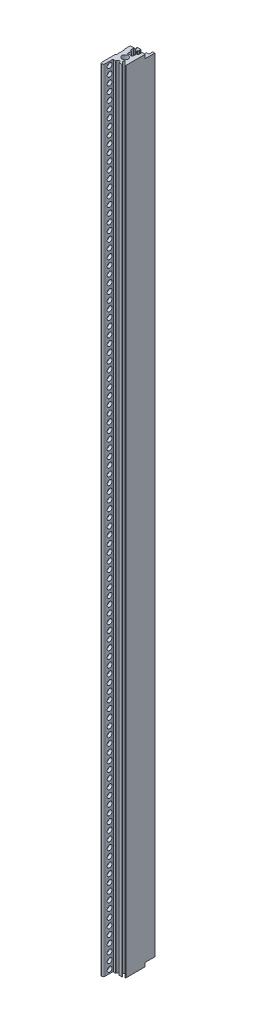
SolidWorks part; units mm, degrees
ref_plane "前视基准面" through (0, 0, 0) normal (0, 0, 1) x (1, 0, 0)
ref_plane "上视基准面" through (0, 0, 0) normal (0, 1, 0) x (1, 0, 0)
ref_plane "右视基准面" through (0, 0, 0) normal (1, 0, 0) x (0, 0, -1)
sketch "草图1" plane through (0, 0, 0) normal (0, 1, 0) x (1, 0, 0)
  line L0 (-4.2, 11.9) -> (-3.9, 11.9)
  line L1 (-4.4, 12.2) -> (-4.4, 12.1)
  line L2 (-4.0328, 12.4) -> (-4.2, 12.4)
  line L3 (-3.85, 12.5) -> (-3.8914, 12.4586)
  line L4 (-2.05, 12.5) -> (-3.85, 12.5)
  line L5 (-2.0086, 12.4586) -> (-2.05, 12.5)
  line L6 (-1.7, 12.4) -> (-1.8672, 12.4)
  line L7 (-1.5, 12.1) -> (-1.5, 12.2)
  line L8 (-1.8, 11.9) -> (-1.7, 11.9)
  line L9 (-2, 11.4828) -> (-2, 11.7)
  line L10 (-1.3586, 10.7586) -> (-1.9414, 11.3414)
  line L11 (-1.3, 10.55) -> (-1.3, 10.6172)
  line L12 (-3.7, 11.7) -> (-3.7, 9.95)
  line L13 (-5, -10.75) -> (-5, -1.6)
  line L14 (-3, -10.75) -> (-3, -5.75)
  line L15 (-2.5, -5.25) -> (-1.15, -5.25)
  line L16 (1.6887, -3.3855) -> (3.2118, -4.9086)
  line L17 (2.5373, -2.537) -> (4.6586, -4.6583)
  line L18 (5, 15) -> (5, 5.1793)
  line L19 (3.6, 15) -> (5, 15)
  line L20 (3.6, 12.5) -> (3.6, 15)
  line L21 (1.95, 12.5) -> (3.6, 12.5)
  line L22 (1.95, 10.55) -> (1.95, 12.5)
  line L23 (2.85, 10.55) -> (1.95, 10.55)
  line L24 (2.85, 9.35) -> (2.85, 10.55)
  line L25 (1.95, 9.35) -> (2.85, 9.35)
  line L26 (1.95, 8.35) -> (1.95, 9.35)
  line L27 (2.85, 8.35) -> (1.95, 8.35)
  line L28 (2.85, 6.05) -> (2.85, 8.35)
  line L29 (1.95, 6.05) -> (2.85, 6.05)
  line L30 (1.95, 3.8856) -> (1.95, 6.05)
  line L31 (-1.45, 6.05) -> (-1.45, 2.9458)
  line L32 (-2.35, 6.05) -> (-1.45, 6.05)
  line L33 (-2.35, 8.35) -> (-2.35, 6.05)
  line L34 (-1.45, 8.35) -> (-2.35, 8.35)
  line L35 (-1.45, 9.35) -> (-1.45, 8.35)
  line L36 (-2.35, 9.35) -> (-1.45, 9.35)
  line L37 (-2.35, 10.55) -> (-2.35, 9.35)
  line L38 (-1.3, 10.55) -> (-2.35, 10.55)
  line L39 (-4.45, 7.7) -> (-4.7, 7.7) construction
  line L40 (-5, 7.4) -> (-4.7, 7.7) construction
  line L41 (-5, 4.4) -> (-5, 7.4)
  line L42 (-4.5499, 3.8998) -> (-5, 4.4)
  line L43 (-4.45, 8.5) -> (-4.45, 9.55)
  line L44 (-3.9, 9.75) -> (-4.25, 9.75)
  line L45 (-4.5499, 3.8998) -> (-4.5501, -1.1002)
  line L46 (-5, -1.6) -> (-4.5501, -1.1002)
  line L47 (4.9414, -1.9395) -> (4.2929, -1.291) construction
  line L48 (5, -2.081) -> (5, -4.5169)
  line L49 (0, 0) -> (0, -5) construction
  line L50 (4, -0.5839) -> (4, 3.6823) construction
  line L51 (-1.05, -5) -> (-1.05, -5.15)
  line L52 (1.05, -5) -> (1.05, -5.15)
  line L53 (1.15, -5.25) -> (3.0703, -5.25)
  line L54 (2.5373, -2.537) -> (1.6887, -3.3855) construction
  line L55 (5, 5.1793) -> (5, -2.081)
  line L56 (-4.45, 8.5) -> (-4.7, 8.5)
  line L57 (-4.7, 8.5) -> (-5, 8.2)
  line L58 (4.9414, 5.0379) -> (4.2929, 4.3894) construction
  line L59 (-5, 8.2) -> (-5, 7.4)
  circle A0 centre (0, 0) radius 1.6
  arc A1 (-4.4, 12.1) -> (-4.2, 11.9) centre (-4.2, 12.1) ccw
  arc A2 (-4.2, 12.4) -> (-4.4, 12.2) centre (-4.2, 12.2) ccw
  arc A3 (-4.0328, 12.4) -> (-3.8914, 12.4586) centre (-4.0328, 12.6) ccw
  arc A4 (-2.0086, 12.4586) -> (-1.8672, 12.4) centre (-1.8672, 12.6) ccw
  arc A5 (-1.5, 12.2) -> (-1.7, 12.4) centre (-1.7, 12.2) ccw
  arc A6 (-1.7, 11.9) -> (-1.5, 12.1) centre (-1.7, 12.1) ccw
  arc A7 (-1.8, 11.9) -> (-2, 11.7) centre (-1.8, 11.7) ccw
  arc A8 (-2, 11.4828) -> (-1.9414, 11.3414) centre (-1.8, 11.4828) ccw
  arc A9 (-1.3, 10.6172) -> (-1.3586, 10.7586) centre (-1.5, 10.6172) ccw
  arc A10 (-5, -10.75) -> (-3, -10.75) centre (-4, -10.75) ccw
  arc A11 (3.0703, -5.25) -> (3.2118, -4.9086) centre (3.0703, -5.05) ccw
  arc A12 (-4.25, 9.75) -> (-4.45, 9.55) centre (-4.25, 9.55) ccw
  arc A13 (-3.9, 9.75) -> (-3.7, 9.95) centre (-3.9, 9.95) ccw
  arc A14 (5, -2.081) -> (4.9414, -1.9395) centre (4.8, -2.081) ccw construction
  arc A15 (4.9414, 5.0379) -> (5, 5.1793) centre (4.8, 5.1793) ccw construction
  arc A16 (4.6586, -4.6583) -> (5, -4.5169) centre (4.8, -4.5169) ccw
  arc A17 (2.5373, -2.537) -> (1.6887, -3.3855) centre (2.113, -2.9613) ccw
  arc A18 (0.7125, 2.9142) -> (-1.1719, 2.7616) centre (0, 0) ccw
  arc A19 (-1.45, 2.9458) -> (-1.1719, 2.7616) centre (-1.25, 2.9458) ccw
  arc A20 (0.7125, 2.9142) -> (1.95, 3.8856) centre (0.95, 3.8856) ccw
  arc A21 (-3.7, 11.7) -> (-3.9, 11.9) centre (-3.9, 11.7) ccw
  arc A22 (4.2929, -1.291) -> (4, -0.5839) centre (5, -0.5839) cw construction
  arc A23 (4, 3.6823) -> (4.2929, 4.3894) centre (5, 3.6823) cw construction
  arc A24 (1.05, -5) -> (-1.05, -5) centre (0, -5) ccw
  arc A25 (1.15, -5.25) -> (1.05, -5.15) centre (1.15, -5.15) cw
  arc A26 (-1.05, -5.15) -> (-1.15, -5.25) centre (-1.15, -5.15) cw
  arc A29 (-3, -5.75) -> (-2.5, -5.25) centre (-2.5, -5.75) cw
  point P104 (1.05, -5.25)
  dimension "D1" = 3.2
  dimension "D2" = 2.1
  dimension "D3" = 5.2
  dimension "D4" = 45
  dimension "D5" = 1.2
  dimension "D7" = 0.6
  dimension "D8" = 0.2
  dimension "D10" = 5
  dimension "D11" = 0.1
  dimension "D12" = 0.25
  dimension "D6" = 3
  dimension "D9" = 2.1225
  dimension "D13" = 0.8
extrude "凸台-拉伸1" add sketch "草图1" along normal mid plane 533.4
sketch "草图7" plane through (0, 266.7, 0) normal (0, 1, 0) x (1, 0, 0)
  line L0 (1.95, 8.35) -> (2.85, 8.35) construction
  line L1 (2.95, 8.35) -> (-2.45, 8.35)
  line L2 (2.95, 8.35) -> (2.95, 5.85)
  line L3 (2.95, 5.85) -> (-2.45, 5.85)
  line L4 (-2.45, 8.35) -> (-2.45, 5.85)
  line L5 (1.95, 10.55) -> (2.85, 10.55) construction
  line L6 (2.95, 10.55) -> (-2.45, 10.55)
  line L7 (2.95, 10.55) -> (2.95, 9.35)
  line L8 (2.95, 9.35) -> (-2.45, 9.35)
  line L9 (-2.45, 10.55) -> (-2.45, 9.35)
  line L10 (-1.45, 9.35) -> (-2.35, 9.35) construction
  line L11 (2.85, 8.35) -> (2.85, 6.05) construction
  line L12 (-2.35, 6.05) -> (-2.35, 8.35) construction
  line L13 (-1.45, 6.05) -> (-2.35, 6.05) construction
  dimension "D1" = 0.1
  dimension "D2" = 0.1
  dimension "D3" = 0.2
extrude "切除-拉伸6" cut sketch "草图7" against normal through all
fillet "圆角1" radius 0.2 8 edges at (2.95, 0, -5.85) (2.95, 0, -8.35) (-2.45, 0, -5.85) (-2.45, 0, -8.35) (-2.45, 0, -9.35) (-2.45, 0, -10.55) (2.95, 0, -9.35) (2.95, 0, -10.55)
sketch "草图2" plane through (0, 266.7, 0) normal (0, 1, 0) x (1, 0, 0)
  circle A0 centre (0, 0) radius 2.1
  dimension "D1" = 4.2
extrude "切除-拉伸1" cut sketch "草图2" against normal blind 10
sketch "草图3" plane through (0, -266.7, 0) normal (0, -1, 0) x (1, 0, 0)
  circle A0 centre (0, 0) radius 2.1
  dimension "D1" = 4.2
extrude "切除-拉伸2" cut sketch "草图3" against normal blind 10
sketch "草图4" plane through (-5, 0, 0) normal (-1, 0, 0) x (0, 0, 1)
  line L0 (1.6, -266.7) -> (10.75, -266.7) construction
  line L1 (11.75, -266.7) -> (11.75, 266.7) construction
  circle A0 centre (7.5, -264.16) radius 1.65
  circle A1 centre (7.5, -259.08) radius 1.65
  circle A2 centre (7.5, -254) radius 1.65
  circle A3 centre (7.5, -248.92) radius 1.65
  circle A4 centre (7.5, -243.84) radius 1.65
  circle A5 centre (7.5, -238.76) radius 1.65
  circle A6 centre (7.5, -233.68) radius 1.65
  circle A7 centre (7.5, -228.6) radius 1.65
  circle A8 centre (7.5, -223.52) radius 1.65
  circle A9 centre (7.5, -218.44) radius 1.65
  circle A10 centre (7.5, -213.36) radius 1.65
  circle A11 centre (7.5, -208.28) radius 1.65
  circle A12 centre (7.5, -203.2) radius 1.65
  circle A13 centre (7.5, -198.12) radius 1.65
  circle A14 centre (7.5, -193.04) radius 1.65
  circle A15 centre (7.5, -187.96) radius 1.65
  circle A16 centre (7.5, -182.88) radius 1.65
  circle A17 centre (7.5, -177.8) radius 1.65
  circle A18 centre (7.5, -172.72) radius 1.65
  circle A19 centre (7.5, -167.64) radius 1.65
  circle A20 centre (7.5, -162.56) radius 1.65
  circle A21 centre (7.5, -157.48) radius 1.65
  circle A22 centre (7.5, -152.4) radius 1.65
  circle A23 centre (7.5, -147.32) radius 1.65
  circle A24 centre (7.5, -142.24) radius 1.65
  circle A25 centre (7.5, -137.16) radius 1.65
  circle A26 centre (7.5, -132.08) radius 1.65
  circle A27 centre (7.5, -127) radius 1.65
  circle A28 centre (7.5, -121.92) radius 1.65
  circle A29 centre (7.5, -116.84) radius 1.65
  circle A30 centre (7.5, -111.76) radius 1.65
  circle A31 centre (7.5, -106.68) radius 1.65
  circle A32 centre (7.5, -101.6) radius 1.65
  circle A33 centre (7.5, -96.52) radius 1.65
  circle A34 centre (7.5, -91.44) radius 1.65
  circle A35 centre (7.5, -86.36) radius 1.65
  circle A36 centre (7.5, -81.28) radius 1.65
  circle A37 centre (7.5, -76.2) radius 1.65
  circle A38 centre (7.5, -71.12) radius 1.65
  circle A39 centre (7.5, -66.04) radius 1.65
  circle A40 centre (7.5, -60.96) radius 1.65
  circle A41 centre (7.5, -55.88) radius 1.65
  circle A42 centre (7.5, -50.8) radius 1.65
  circle A43 centre (7.5, -45.72) radius 1.65
  circle A44 centre (7.5, -40.64) radius 1.65
  circle A45 centre (7.5, -35.56) radius 1.65
  circle A46 centre (7.5, -30.48) radius 1.65
  circle A47 centre (7.5, -25.4) radius 1.65
  circle A48 centre (7.5, -20.32) radius 1.65
  circle A49 centre (7.5, -15.24) radius 1.65
  circle A50 centre (7.5, -10.16) radius 1.65
  circle A51 centre (7.5, -5.08) radius 1.65
  circle A52 centre (7.5, 0) radius 1.65
  circle A53 centre (7.5, 5.08) radius 1.65
  circle A54 centre (7.5, 10.16) radius 1.65
  circle A55 centre (7.5, 15.24) radius 1.65
  circle A56 centre (7.5, 20.32) radius 1.65
  circle A57 centre (7.5, 25.4) radius 1.65
  circle A58 centre (7.5, 30.48) radius 1.65
  circle A59 centre (7.5, 35.56) radius 1.65
  circle A60 centre (7.5, 40.64) radius 1.65
  circle A61 centre (7.5, 45.72) radius 1.65
  circle A62 centre (7.5, 50.8) radius 1.65
  circle A63 centre (7.5, 55.88) radius 1.65
  circle A64 centre (7.5, 60.96) radius 1.65
  circle A65 centre (7.5, 66.04) radius 1.65
  circle A66 centre (7.5, 71.12) radius 1.65
  circle A67 centre (7.5, 76.2) radius 1.65
  circle A68 centre (7.5, 81.28) radius 1.65
  circle A69 centre (7.5, 86.36) radius 1.65
  circle A70 centre (7.5, 91.44) radius 1.65
  circle A71 centre (7.5, 96.52) radius 1.65
  circle A72 centre (7.5, 101.6) radius 1.65
  circle A73 centre (7.5, 106.68) radius 1.65
  circle A74 centre (7.5, 111.76) radius 1.65
  circle A75 centre (7.5, 116.84) radius 1.65
  circle A76 centre (7.5, 121.92) radius 1.65
  circle A77 centre (7.5, 127) radius 1.65
  circle A78 centre (7.5, 132.08) radius 1.65
  circle A79 centre (7.5, 137.16) radius 1.65
  circle A80 centre (7.5, 142.24) radius 1.65
  circle A81 centre (7.5, 147.32) radius 1.65
  circle A82 centre (7.5, 152.4) radius 1.65
  circle A83 centre (7.5, 157.48) radius 1.65
  circle A84 centre (7.5, 162.56) radius 1.65
  circle A85 centre (7.5, 223.52) radius 1.65
  circle A86 centre (7.5, 248.92) radius 1.65
  circle A87 centre (7.5, 182.88) radius 1.65
  circle A88 centre (7.5, 218.44) radius 1.65
  circle A89 centre (7.5, 167.64) radius 1.65
  circle A90 centre (7.5, 198.12) radius 1.65
  circle A91 centre (7.5, 254) radius 1.65
  circle A92 centre (7.5, 193.04) radius 1.65
  circle A93 centre (7.5, 208.28) radius 1.65
  circle A94 centre (7.5, 243.84) radius 1.65
  circle A95 centre (7.5, 187.96) radius 1.65
  circle A96 centre (7.5, 203.2) radius 1.65
  circle A97 centre (7.5, 259.08) radius 1.65
  circle A98 centre (7.5, 213.36) radius 1.65
  circle A99 centre (7.5, 177.8) radius 1.65
  circle A100 centre (7.5, 228.6) radius 1.65
  circle A101 centre (7.5, 233.68) radius 1.65
  circle A102 centre (7.5, 238.76) radius 1.65
  circle A103 centre (7.5, 172.72) radius 1.65
  circle A108 centre (7.5, 264.16) radius 1.65
  dimension "D1" = 2.54
  dimension "D2" = 4.25
  dimension "D3" = 3.3
  dimension "D5" = 5.08
  dimension "D4" = 85
extrude "切除-拉伸3" cut sketch "草图4" against normal blind 12
sketch "草图5" plane through (5, 0, 0) normal (1, 0, 0) x (0, 0, -1)
  line L0 (15, 0) -> (41.1348, 0) construction
  line L1 (15, 266.7) -> (8.5, 266.7)
  line L2 (15, 266.7) -> (15, 264.16)
  line L3 (15, 264.16) -> (8.5, 264.16)
  line L4 (8.5, 266.7) -> (8.5, 264.16)
  line L5 (15, 266.7) -> (15, -266.7) construction
  line L6 (8.5, -266.7) -> (8.5, -264.16)
  line L7 (15, -264.16) -> (8.5, -264.16)
  line L8 (15, -266.7) -> (15, -264.16)
  line L9 (15, -266.7) -> (8.5, -266.7)
  dimension "D1" = 6.5
  dimension "D2" = 2.54
extrude "切除-拉伸4" cut sketch "草图5" against normal blind 10
